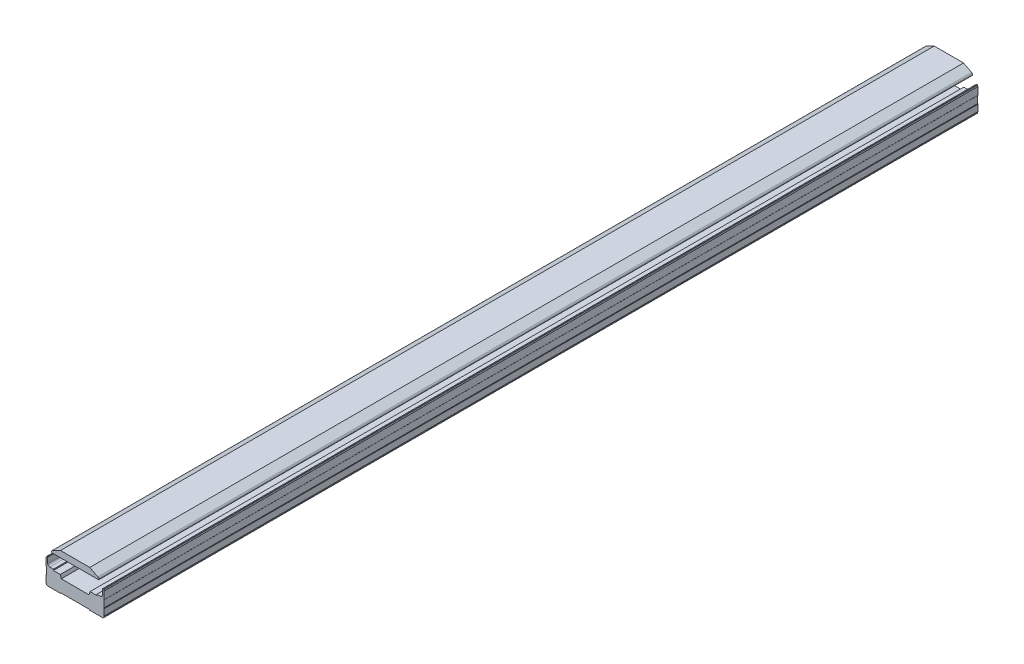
SolidWorks part; units mm, degrees
ref_plane "前视基准面" through (0, 0, 0) normal (0, 0, 1) x (1, 0, 0)
ref_plane "上视基准面" through (0, 0, 0) normal (0, 1, 0) x (1, 0, 0)
ref_plane "右视基准面" through (0, 0, 0) normal (1, 0, 0) x (0, 0, -1)
sketch "草图1" plane through (0, 0, 0) normal (0, 0, 1) x (1, 0, 0)
  line B0 (39.862, 56.7646) -> (25.6617, 64)
  line B1 (25.6617, 64) -> (24.5533, 64)
  line B2 (24.5533, 64) -> (-24.5533, 64)
  line B3 (-24.5533, 64) -> (-25.6617, 64)
  line B4 (-25.6617, 64) -> (-39.862, 56.7646)
  line B5 (-41.5, 54.0916) -> (-41.5, 53.4)
  line B6 (-41.1, 53) -> (41.1, 53)
  line B7 (41.5, 53.4) -> (41.5, 54.0916)
  line B8 (-24.5, 0) -> (24.5, 0)
  line B9 (24.5, 0) -> (25.5, -1)
  line B10 (25.5, -1) -> (49, -1)
  line B11 (50.1411, 0.5056) -> (51, 3)
  line B12 (51, 3) -> (51, 14.134)
  line B13 (50.5, 15) -> (50.5, 27)
  line B14 (51, 27.866) -> (51, 40.882)
  line B15 (50.9538, 41.0921) -> (50.1382, 42.7236)
  line B16 (49.691, 43) -> (48.3, 43)
  line B17 (48, 42.7) -> (48, 33)
  line B18 (44.5, 29.5) -> (38, 29.5)
  line B19 (38, 29.5) -> (38, 27.5)
  line B20 (38, 27.5) -> (26, 27.5)
  line B21 (26, 27.5) -> (24.1966, 21.7805)
  line B22 (24.1966, 21.7805) -> (-24.1966, 21.7805)
  line B23 (-24.1966, 21.7805) -> (-26, 27.5)
  line B24 (-26, 27.5) -> (-38, 27.5)
  line B25 (-38, 27.5) -> (-38, 29.5)
  line B26 (-38, 29.5) -> (-44.5, 29.5)
  line B27 (-48, 33) -> (-48, 42.7)
  line B28 (-48.3, 43) -> (-49.691, 43)
  line B29 (-50.1382, 42.7236) -> (-50.9538, 41.0921)
  line B30 (-51, 40.882) -> (-51, 27.866)
  line B31 (-50.5, 27) -> (-50.5, 15)
  line B32 (-51, 14.134) -> (-51, 3)
  line B33 (-51, 3) -> (-50.1411, 0.5056)
  line B34 (-49, -1) -> (-25.5, -1)
  line B35 (-25.5, -1) -> (-24.5, 0)
  arc B36 (-39.862, 56.7646) -> (-41.5, 54.0916) centre (-38.5, 54.0916) ccw
  arc B37 (-41.5, 53.4) -> (-41.1, 53) centre (-41.1, 53.4) ccw
  arc B38 (41.1, 53) -> (41.5, 53.4) centre (41.1, 53.4) ccw
  arc B39 (41.5, 54.0916) -> (39.862, 56.7646) centre (38.5, 54.0916) ccw
  arc B40 (49, -1) -> (50.1411, 0.5056) centre (47.3012, 1.4727) ccw
  arc B41 (51, 14.134) -> (50.75, 14.567) centre (50.5, 14.134) ccw
  arc B42 (50.5, 15) -> (50.75, 14.567) centre (51, 15) ccw
  arc B43 (50.75, 27.433) -> (50.5, 27) centre (51, 27) ccw
  arc B44 (50.75, 27.433) -> (51, 27.866) centre (50.5, 27.866) ccw
  arc B45 (51, 40.882) -> (50.9538, 41.0921) centre (50.5004, 40.8823) ccw
  arc B46 (50.1382, 42.7236) -> (49.691, 43) centre (49.691, 42.5) ccw
  arc B47 (48.3, 43) -> (48, 42.7) centre (48.3, 42.7) ccw
  arc B48 (44.5, 29.5) -> (48, 33) centre (44.5, 33) ccw
  arc B49 (-48, 33) -> (-44.5, 29.5) centre (-44.5, 33) ccw
  arc B50 (-48, 42.7) -> (-48.3, 43) centre (-48.3, 42.7) ccw
  arc B51 (-49.691, 43) -> (-50.1382, 42.7236) centre (-49.691, 42.5) ccw
  arc B52 (-50.9538, 41.0921) -> (-51, 40.882) centre (-50.5004, 40.8823) ccw
  arc B53 (-51, 27.866) -> (-50.75, 27.433) centre (-50.5, 27.866) ccw
  arc B54 (-50.5, 27) -> (-50.75, 27.433) centre (-51, 27) ccw
  arc B55 (-50.75, 14.567) -> (-50.5, 15) centre (-51, 15) ccw
  arc B56 (-50.75, 14.567) -> (-51, 14.134) centre (-50.5, 14.134) ccw
  arc B57 (-50.1411, 0.5056) -> (-49, -1) centre (-47.3013, 1.4727) ccw
sketch_block_instance "块1-1"
sketch_block "块1"
extrude "凸台-拉伸1" add sketch "草图1" against normal blind 1530
hole_wizard "打孔尺寸(%根据)内六角圆柱头螺钉的类型1" positions "草图3" profile "草图4" counterbore size "M5" standard "GB"
sketch "草图3" plane through (0, 43, 0) normal (0, 1, 0) x (1, 0, 0)
  line L5 (0, 1530) -> (0, 1140.2602) construction
  line L7 (25.6617, 1530) -> (-25.6617, 1530) construction
  line L8 (25.5, 1530) -> (49, 1530) construction
  point P0 (-42.5, 1479.5)
  point P2 (42.5, 1479.5)
  point P13 (42.5, 1429.5)
  point P15 (-42.5, 1429.5)
  point P22 (42.5, 1229.5)
  point P24 (-42.5, 1229.5)
  point P25 (42.5, 1029.5)
  point P27 (-42.5, 1029.5)
  point P29 (42.5, 829.5)
  point P31 (-42.5, 829.5)
  point P33 (42.5, 629.5)
  point P35 (-42.5, 629.5)
  point P45 (-42.5, 429.5)
  point P47 (42.5, 429.5)
  point P53 (-42.5, 229.5)
  point P57 (-42.5, 29.5)
  point P59 (-42.5, -170.5)
  point P60 (42.5, -170.5)
  point P61 (42.5, 29.5)
  point P62 (42.5, 229.5)
  dimension "D1" = 85
  dimension "D2" = 200
  dimension "D3" = 50.5
  dimension "D4" = 50
  dimension "D5" = 200
  dimension "D6" = 200
  dimension "D7" = 200
  dimension "D8" = 200
  dimension "D9" = 200
  dimension "D10" = 200
  dimension "D11" = 200
sketch "草图4" plane through (-42.5, 43, -1479.5) normal (1, 0, 0) x (0, 0, 1)
  line L0 (0, 0) -> (0, 44)
  line L1 (0, 44) -> (2.75, 44)
  line L3 (2.75, 44) -> (2.75, 30.5)
  line L4 (2.75, 30.5) -> (5, 30.5)
  line L5 (5, 30.5) -> (5, 0)
  line L7 (5, 0) -> (0, 0)
  line L11 (0, -6.35) -> (0, 107.95) construction
  dimension "通孔孔直径" = 5.5
  dimension "通孔孔深度" = 44
  dimension "柱形沉头孔直径" = 10
  dimension "柱形沉头孔深度" = 30.5
hole_wizard "M5 螺纹孔1" positions "草图5" profile "草图6" tap size "M5" standard "GB"
sketch "草图5" plane through (0, -1, 0) normal (0, -1, 0) x (-1, 0, 0)
  line L0 (42.5, 1479.5) -> (42.5, 1489.5) construction
  line L1 (-42.5, 1479.5) -> (-42.5, 1489.5) construction
  line L5 (49, 1530) -> (25.5, 1530) construction
  point P0 (42.5, 1489.5)
  point P2 (-42.5, 1489.5)
  point P12 (42.5, 1439.5)
  point P14 (-42.5, 1439.5)
  point P19 (-42.5, 1239.5)
  point P21 (42.5, 1239.5)
  point P23 (-42.5, 1039.5)
  point P25 (42.5, 1039.5)
  point P27 (-42.5, 839.5)
  point P29 (42.5, 839.5)
  point P31 (-42.5, 639.5)
  point P33 (42.5, 639.5)
  point P36 (42.5, 439.5)
  point P38 (-42.5, 439.5)
  point P41 (42.5, 239.5)
  point P43 (42.5, 39.5)
  point P45 (42.5, -160.5)
  point P50 (-42.5, -160.5)
  point P52 (-42.5, 39.5)
  point P54 (-42.5, 239.5)
  dimension "D1" = 40.5
  dimension "D2" = 50
  dimension "D3" = 200
  dimension "D4" = 200
  dimension "D5" = 200
  dimension "D6" = 200
  dimension "D7" = 200
  dimension "D8" = 200
  dimension "D9" = 200
  dimension "D10" = 200
sketch "草图6" plane through (-42.5, -1, -1489.5) normal (1, 0, 0) x (0, 0, -1)
  line L0 (0, 0) -> (0, 13.6618)
  line L1 (0, 13.6618) -> (2.1, 12.4)
  line L2 (2.1, 12.4) -> (2.1, 0)
  line L5 (2.1, 0) -> (0, 0)
  line L10 (0, 13.6618) -> (-2.1, 12.4) construction
  line L11 (0, -6.35) -> (0, 107.95) construction
  dimension "螺纹孔钻头直径" = 4.2
  dimension "螺纹孔钻头深度" = 12.4
  dimension "导头角度" = 118
